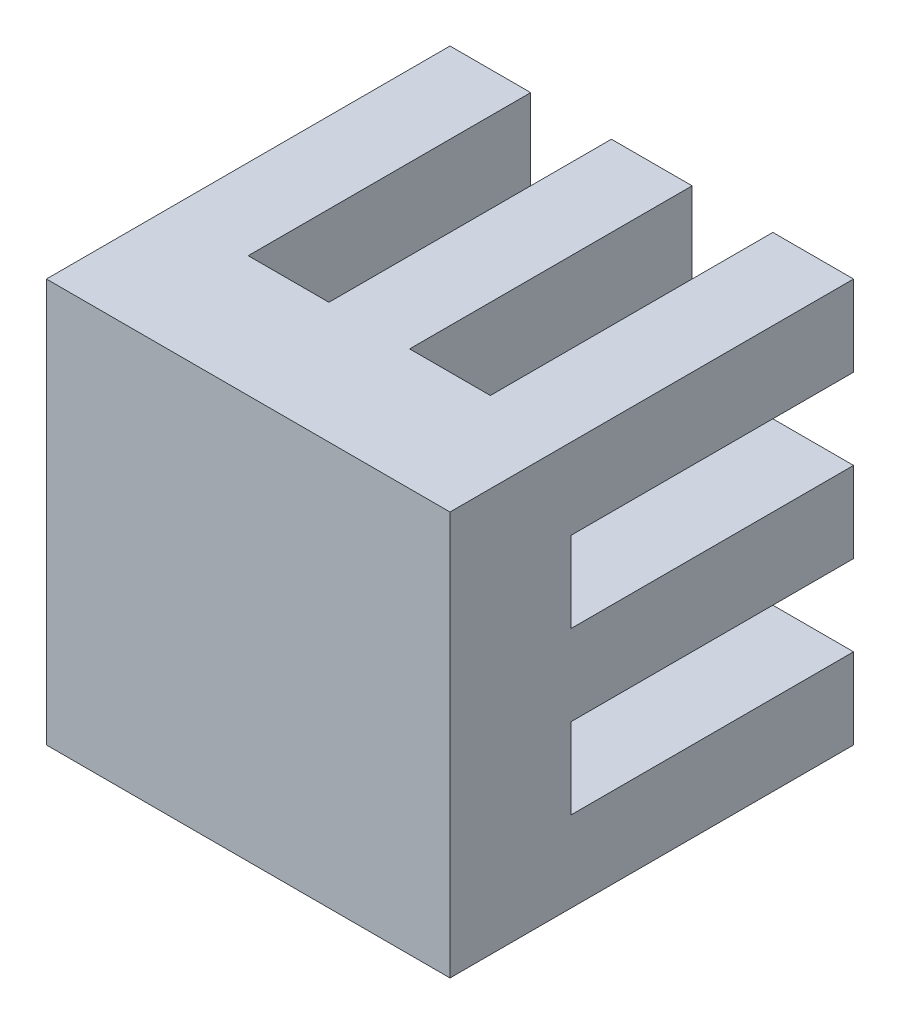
SolidWorks part; units mm, degrees
ref_plane "前视基准面" through (0, 0, 0) normal (0, 0, 1) x (1, 0, 0)
ref_plane "上视基准面" through (0, 0, 0) normal (0, 1, 0) x (1, 0, 0)
ref_plane "右视基准面" through (0, 0, 0) normal (1, 0, 0) x (0, 0, -1)
sketch "草图1" plane through (0, 0, 0) normal (0, 1, 0) x (1, 0, 0)
  line L1 (0, 0) -> (10, 0)
  line L2 (0, 0) -> (0, -10)
  line L3 (0, -10) -> (10, -10)
  line L4 (10, 0) -> (10, -10)
  dimension "D1" = 10
  dimension "D2" = 10
extrude "凸台-拉伸1" add sketch "草图1" along normal blind 10
sketch "草图2" plane through (0, 10, 0) normal (0, 1, 0) x (1, 0, 0)
  line L0 (10, 0) -> (0, 0) construction
  line L1 (2, 0) -> (4, 0)
  line L2 (2, 0) -> (2, -7)
  line L3 (2, -7) -> (4, -7)
  line L4 (4, 0) -> (4, -7)
  line L5 (0, -10) -> (10, -10) construction
  line L6 (0, 0) -> (0, -10) construction
  dimension "D1" = 3
  dimension "D2" = 2
  dimension "D3" = 2
extrude "切除-拉伸1" cut sketch "草图2" against normal blind 10
pattern_linear "阵列(线性)1" count 2 spacing 4 along (1, 0, 0) of "切除-拉伸1"
sketch "草图3" plane through (0, 0, 0) normal (0, 0, -1) x (-1, 0, 0)
  line L0 (-10, 10) -> (-10, 0) construction
  line L1 (-10, 4) -> (0, 4)
  line L2 (-10, 4) -> (-10, 2)
  line L3 (-10, 2) -> (0, 2)
  line L4 (0, 4) -> (0, 2)
  line L5 (0, 10) -> (0, 0) construction
  line L6 (-10, 0) -> (-8, 0) construction
  dimension "D1" = 2
  dimension "D2" = 2
extrude "切除-拉伸2" cut sketch "草图3" against normal blind 7
pattern_linear "阵列(线性)3" count 2 spacing 4 along (0, 1, 0) of "切除-拉伸2"
